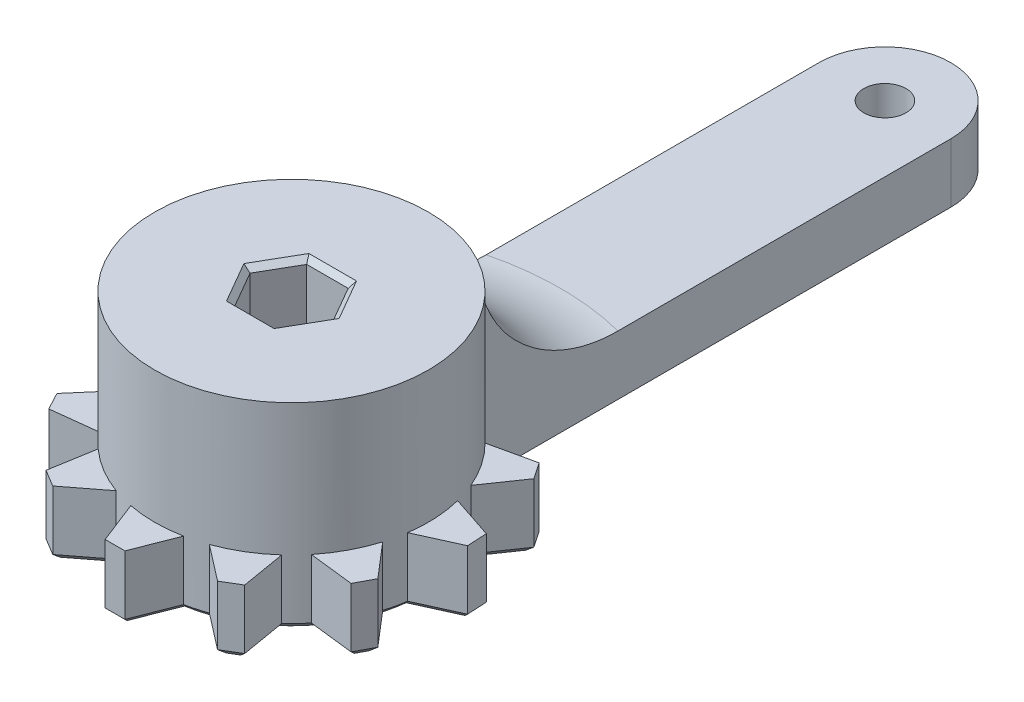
SolidWorks part; units mm, degrees
ref_plane "Front Plane" through (0, 0, 0) normal (0, 0, 1) x (1, 0, 0)
ref_plane "Top Plane" through (0, 0, 0) normal (0, 1, 0) x (1, 0, 0)
ref_plane "Right Plane" through (0, 0, 0) normal (1, 0, 0) x (0, 0, -1)
sketch "Sketch1" plane through (0, 0, 0) normal (0, 1, 0) x (1, 0, 0)
  line L0 (0, 0) -> (0, 45) construction
  line L1 (-5, 0) -> (-5, 45)
  line L2 (5, 0) -> (5, 45)
  circle A0 centre (0, 0) radius 10.38
  arc A1 (-5, 0) -> (5, 0) centre (0, 0) ccw
  arc A2 (5, 45) -> (-5, 45) centre (0, 45) ccw
  circle A3 centre (0, 45) radius 1.6
  circle A4 centre (0, 0) radius 1.6
  point P3 (0, 22.5)
  dimension "D1" = 20.76
  dimension "D4" = 3.2
  dimension "D5" = 3.2
  dimension "D2" = 10
  dimension "D3" = 45
extrude "Boss-Extrude1" add sketch "Sketch1" along normal blind 5
sketch "Sketch2" plane through (0, 5, 0) normal (0, 1, 0) x (1, 0, 0)
  line L0 (0, -10.38) -> (0, -13.38) construction
  line L1 (-0.75, -13.38) -> (0.75, -13.38)
  line L2 (0.75, -13.38) -> (2, -10.1855)
  line L3 (-0.75, -13.38) -> (-2, -10.1855)
  arc A0 (-5, 9.0964) -> (5, 9.0964) centre (0, 0) ccw construction
  arc A1 (-2, -10.1855) -> (2, -10.1855) centre (0, 0) ccw
  point P14 (0, -13.38)
  dimension "D1" = 3
  dimension "D2" = 1.5
  dimension "D3" = 4
extrude "Boss-Extrude2" add sketch "Sketch2" against normal up to surface (5 mm away)
pattern_circular "CirPattern1" count 5 every 31 about axis through (0, 0, 0) along (0, 1, 0) of "Boss-Extrude2"
sketch "Sketch3" plane through (0, 5, 0) normal (0, 1, 0) x (1, 0, 0)
  circle A0 centre (0, 0) radius 5.975
  circle A1 centre (0, 0) radius 1.6
  circle A2 centre (0, 0) radius 3.25
  arc A3 (7.3258, 7.3537) -> (5, 9.0964) centre (0, 0) ccw construction
  dimension "D1" = 11.95
  dimension "D2" = 6.5
  dimension "D3" = 3.2
extrude "Boss-Extrude3" [suppressed] add sketch "Sketch3" along normal blind 6.6 contours A0 A2
chamfer "Chamfer1" [suppressed] distance 1 angle 45
chamfer "Chamfer2" [suppressed] distance 0.5 angle 45
sketch "Sketch4" plane through (0, 5, 0) normal (0, 1, 0) x (1, 0, 0)
  circle A0 centre (0, 0) radius 10.38
  circle A1 centre (0, 0) radius 1.6
  circle A2 centre (0, 0) radius 1.6 construction
  arc A3 (-10.2762, -1.4642) -> (-9.9322, -3.0159) centre (0, 0) ccw construction
extrude "Boss-Extrude4" add sketch "Sketch4" along normal blind 10
fillet "Fillet1" radius 10 1 edges at (0, 5, -10.38)
chamfer "Chamfer3" distance 0.5 angle 45 42 edges at (-6.2242, 0, -8.3069) (9.8436, 0, -3.2936) (11.8386, 0, 0.7565) (11.6946, 0, -1.9898) (13.3617, 0, -0.7003) (-5, 0, -27.0482) (6.2242, 0, -8.3069) (10.5372, 0, -5.4489) (8.9995, 0, -7.7288) (11.0925, 0, -7.482) (2.7739, 0, 10.0025) (-1.375, 0, 11.7827) (1.375, 0, 11.7827) (0, 0, 13.38) (-2.7739, 0, 10.0025) (-7.2472, 0, 9.3916) (-4.89, 0, 10.808) (-6.8912, 0, 11.4689) (-7.5294, 0, 7.1451) (-11.0491, 0, 4.3176) (-9.758, 0, 6.7457) (-11.8138, 0, 6.2815) (-10.134, 0, 2.2466) (-11.6946, 0, -1.9898) (-11.8386, 0, 0.7565) (-13.3617, 0, -0.7003) (-9.8436, 0, -3.2936) (-8.9995, 0, -7.7288) (-10.5372, 0, -5.4489) (-11.0925, 0, -7.482) (7.5294, 0, 7.1451) (0, 0, 1.6) (4.89, 0, 10.808) (7.2472, 0, 9.3916) (6.8912, 0, 11.4689) (0, 0, -43.4) (0, 0, -50) (10.134, 0, 2.2466) (9.758, 0, 6.7457) (11.0491, 0, 4.3176) (11.8138, 0, 6.2815) (5, 0, -27.0482)
sketch "Sketch5" plane through (0, 15, 0) normal (0, 1, 0) x (1, 0, 0)
  line L0 (-8.6325, 0) -> (8.6325, 0) construction
  line L1 (1.5733, 2.725) -> (-1.5733, 2.725)
  line L2 (-1.5733, 2.725) -> (-3.1466, 0)
  line L3 (-3.1466, 0) -> (-1.5733, -2.725)
  line L4 (-1.5733, -2.725) -> (1.5733, -2.725)
  line L5 (1.5733, -2.725) -> (3.1466, 0)
  line L6 (3.1466, 0) -> (1.5733, 2.725)
  circle A0 centre (0, 0) radius 2.725 construction
  point P1 (0, 2.725)
  dimension "D1" = 5.45
extrude "Cut-Extrude1" cut sketch "Sketch5" against normal blind 4.5
chamfer "Chamfer4" distance 0.4 angle 45 6 edges at (2.3599, 15, -1.3625) (2.3599, 15, 1.3625) (0, 15, 2.725) (-2.3599, 15, 1.3625) (-2.3599, 15, -1.3625) (0, 15, -2.725)
